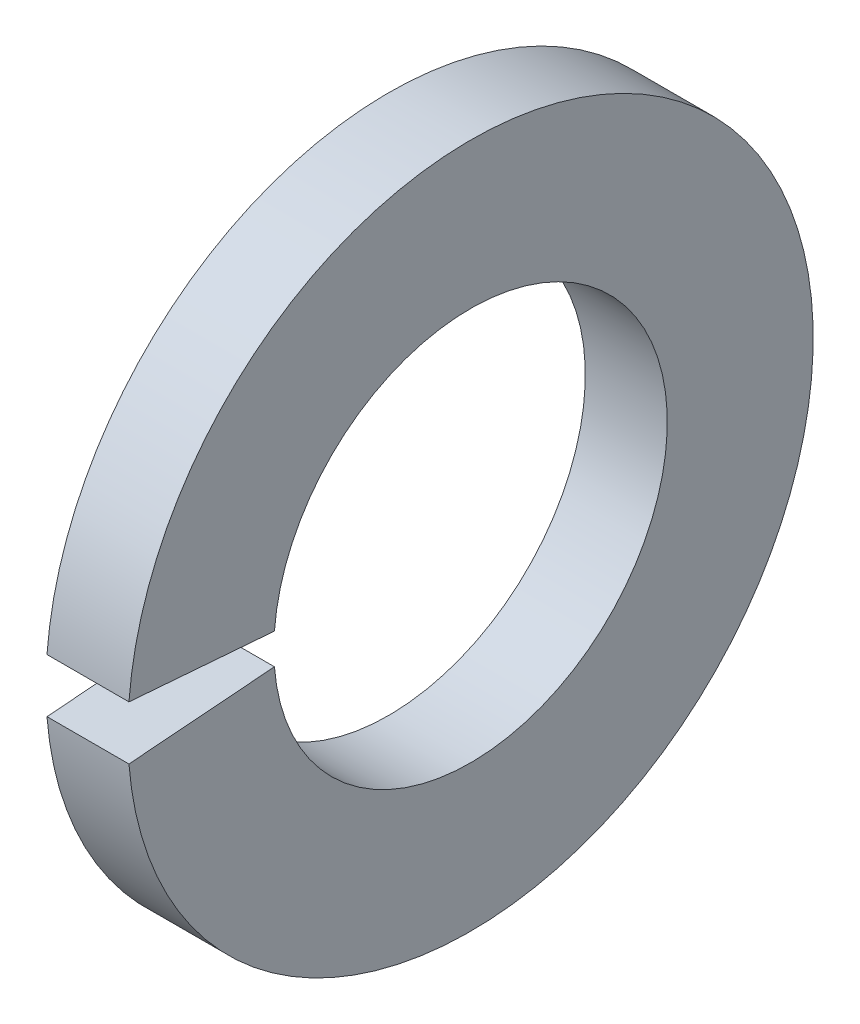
SolidWorks part; units mm, degrees
ref_plane "Plane1" through (0, 0, 0) normal (0, 0, 1) x (1, 0, 0)
ref_plane "Plane2" through (0, 0, 0) normal (0, 1, 0) x (1, 0, 0)
ref_plane "Plane3" through (0, 0, 0) normal (1, 0, 0) x (0, 0, -1)
sketch "Sketch1" plane through (0, 0, 0) normal (0, 0, 1) x (1, 0, 0)
  line L0 (-34.925, 0) -> (9.525, 0) construction
  line L1 (0, 1.524) -> (0, 2.6543)
  line L2 (0, 2.6543) -> (-0.635, 2.6543)
  line L3 (-0.635, 2.6543) -> (-0.635, 1.524)
  line L4 (-0.635, 1.524) -> (0, 1.524)
revolve "Base-Revolve" add sketch "Sketch1" angle 360 about L0
sketch "Sketch2" plane through (0, 0, 0) normal (-1, 0, 0) x (0, -1, 0)
  line L0 (0, 0) -> (0.2124, 2.699)
  line L1 (0, -3.175) -> (0, 12.7) construction
  line L2 (0, 0) -> (-0.2124, 2.699)
  arc A0 (0.2124, 2.699) -> (-0.2124, 2.699) centre (0, 0) ccw
extrude "Gap" cut sketch "Sketch2" along normal through all
equation "\"D1@Sketch2\" = \"Outside_dia@Sketch1\" * 0.51"
